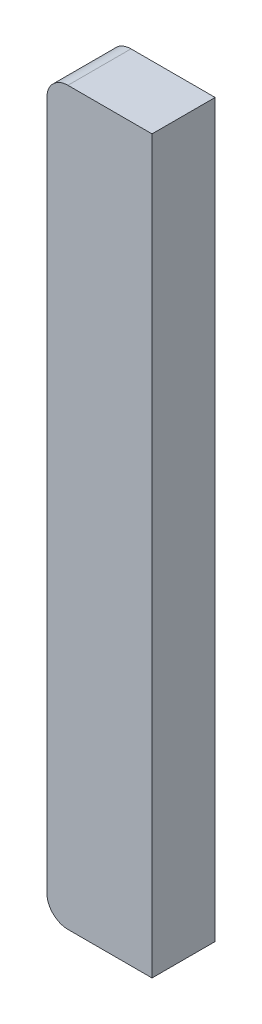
SolidWorks part; units mm, degrees
ref_plane "Plan de face" through (0, 0, 0) normal (0, 0, 1) x (1, 0, 0)
ref_plane "Plan de dessus" through (0, 0, 0) normal (0, 1, 0) x (1, 0, 0)
ref_plane "Plan de droite" through (0, 0, 0) normal (1, 0, 0) x (0, 0, -1)
sketch "Esquisse1" plane through (0, 0, 0) normal (0, 0, 1) x (1, 0, 0)
  line L0 (0, -7.9099) -> (0, -28.0143) construction
  line L1 (14.8224, -42.6651) -> (-4, -42.6651) construction
  line L2 (0, -7.9099) -> (0, -42.6651)
  line L3 (0, -42.6651) -> (-4, -42.6651)
  line L4 (-5, -41.6651) -> (-5, -8.9099)
  line L5 (-5, -41.6651) -> (-5, -1.2) construction
  line L6 (-4, -7.9099) -> (0, -7.9099)
  arc A0 (-5, -41.6651) -> (-4, -42.6651) centre (-4, -41.6651) ccw construction
  arc A1 (-5, -41.6651) -> (-4, -42.6651) centre (-4, -41.6651) ccw
  arc A2 (-5, -8.9099) -> (-4, -7.9099) centre (-4, -8.9099) cw
  point P12 (-5, -7.9099)
  dimension "D1" = 1
extrude "Boss.-Extru.2" add sketch "Esquisse1" along normal blind 3
